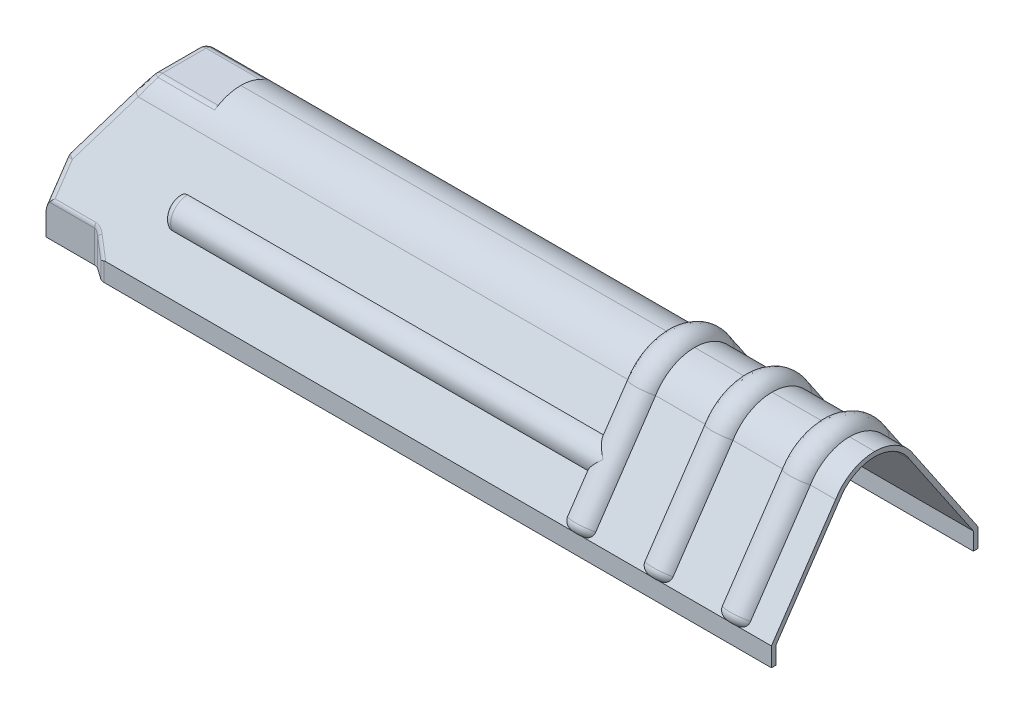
SolidWorks part; units mm, degrees
ref_plane "Front Plane" through (0, 0, 0) normal (0, 0, 1) x (1, 0, 0)
ref_plane "Top Plane" through (0, 0, 0) normal (0, 1, 0) x (1, 0, 0)
ref_plane "Right Plane" through (0, 0, 0) normal (1, 0, 0) x (0, 0, -1)
sketch "Sketch1" plane through (0, 0, 0) normal (0, 1, 0) x (1, 0, 0)
  line L0 (116.9121, 33.1724) -> (116.9121, -2.6924)
  line L3 (116.9121, 33.1724) -> (12.192, 33.1724)
  line L4 (12.192, -2.6924) -> (116.9121, -2.6924)
  line L5 (8.382, 0) -> (12.192, -2.6924)
  line L6 (12.192, 33.1724) -> (8.382, 30.48)
  line L7 (8.382, 30.48) -> (0, 30.48)
  line L8 (0, 30.48) -> (0, 0)
  line L10 (0, 0) -> (8.382, 0)
extrude "Boss-Extrude1" add sketch "Sketch1" along normal blind 50.8
sketch "Sketch2" plane through (0, 0, 0) normal (1, 0, 0) x (0, 0, -1)
  line L0 (15.24, 0) -> (15.24, 50.8) construction
  line L1 (-2.6924, 0) -> (33.1724, 0) construction
  line L2 (-2.6924, 50.8) -> (33.1724, 50.8) construction
  line L3 (-1.708, 0.6876) -> (-1.708, -0.0109)
  line L4 (-1.708, 3.1097) -> (-1.708, 0.6876)
  line L5 (1.6554, 8.0681) -> (-1.708, 3.1097)
  line L6 (8.8279, 18.6417) -> (1.6554, 8.0681)
  line L7 (32.188, -0.0109) -> (29.6545, -0.0109)
  line L8 (0.8255, -4.7972) -> (0.8255, -0.0109)
  line L9 (-8.1002, -4.7972) -> (0.8255, -4.7972)
  line L10 (-8.1002, 57.4184) -> (-8.1002, -4.7972)
  line L11 (38.5707, 57.4184) -> (-8.1002, 57.4184)
  line L12 (-1.708, -0.0109) -> (0.8255, -0.0109)
  line L17 (-8.0907, 57.4184) -> (38.5802, 57.4184)
  line L20 (38.5802, 57.4184) -> (38.5802, -4.7972)
  line L22 (38.5802, -4.7972) -> (29.6545, -4.7972)
  line L25 (29.6545, -4.7972) -> (29.6545, -0.0109)
  line L28 (21.6521, 18.6417) -> (28.8246, 8.0681)
  line L29 (28.8246, 8.0681) -> (32.188, 3.1097)
  line L30 (32.188, 3.1097) -> (32.188, 0.6876)
  line L34 (32.188, 0.6876) -> (32.188, -0.0109)
  arc A0 (21.6521, 18.6417) -> (8.8214, 18.6526) centre (15.2335, 14.7941) ccw
  arc A1 (8.8279, 18.6417) -> (21.6586, 18.6526) centre (15.2465, 14.7941) cw
  point P9 (-0.4445, 0)
  point P34 (30.9245, 0)
extrude "Cut-Extrude1" cut sketch "Sketch2" along normal through all
sketch "Sketch4" plane through (0, 0, 0) normal (0, 0, 1) x (1, 0, 0)
  line L0 (16.721, 22.9468) -> (-14.4484, 22.9468)
  line L1 (-14.4484, 22.9468) -> (-12.1824, 0)
  line L2 (16.721, 21.1478) -> (6.721, 21.1478)
  line L3 (6.721, 21.1478) -> (0, 9.77)
  line L4 (0, 18.6417) -> (0, 5.6276) construction
  line L5 (0, 9.77) -> (0, 0)
  line L6 (16.721, 21.1478) -> (16.721, 22.9468)
  line L7 (-12.1824, 0) -> (-0.17, 0)
  line L8 (0, 0) -> (-0.17, 0)
  dimension "D1" = 10
extrude "Cut-Extrude3" cut sketch "Sketch4" against normal through all
shell "Shell2" thickness 0.762
ref_plane "Plane1" through (116.9121, 0, 0) normal (1, 0, 0) x (0, 0, -1)
sketch "Sketch5" plane through (116.9121, 0, 0) normal (1, 0, 0) x (0, 0, -1)
  line L10 (21.0092, 18.2321) -> (31.426, 2.8757)
  line L11 (31.426, 2.8757) -> (31.426, 0)
  line L12 (31.426, 0) -> (32.188, 0)
  line L13 (32.188, 0) -> (32.188, 3.1097)
  line L14 (32.188, 3.1097) -> (21.6521, 18.6417)
  line L15 (8.8279, 18.6417) -> (-1.708, 3.1097)
  line L16 (-1.708, 3.1097) -> (-1.708, 0)
  line L17 (-1.708, 0) -> (-0.946, 0)
  line L18 (-0.946, 0) -> (-0.946, 2.8757)
  line L19 (-0.946, 2.8757) -> (9.4708, 18.2321)
  line L20 (21.0092, 18.2321) -> (31.426, 2.8757)
  line L21 (31.426, 2.8757) -> (31.426, 0)
  line L22 (31.426, 0) -> (32.188, 0)
  line L23 (32.188, 0) -> (32.188, 3.1097)
  line L24 (32.188, 3.1097) -> (21.6521, 18.6417)
  line L25 (8.8279, 18.6417) -> (-1.708, 3.1097)
  line L26 (-1.708, 3.1097) -> (-1.708, 0)
  line L27 (-1.708, 0) -> (-0.946, 0)
  line L28 (-0.946, 0) -> (-0.946, 2.8757)
  line L29 (-0.946, 2.8757) -> (9.4708, 18.2321)
  arc A4 (21.6521, 18.6417) -> (15.24, 22.2776) centre (15.2335, 14.7941) ccw
  arc A5 (15.24, 22.2776) -> (8.8279, 18.6417) centre (15.2465, 14.7941) ccw
  arc A6 (15.24, 21.5156) -> (9.4708, 18.2321) centre (15.2465, 14.7941) ccw
  arc A7 (21.0092, 18.2321) -> (15.24, 21.5156) centre (15.2335, 14.7941) ccw
  arc A8 (21.6521, 18.6417) -> (15.24, 22.2776) centre (15.2335, 14.7941) ccw
  arc A9 (15.24, 22.2776) -> (8.8279, 18.6417) centre (15.2465, 14.7941) ccw
  arc A10 (15.24, 21.5156) -> (9.4708, 18.2321) centre (15.2465, 14.7941) ccw
  arc A11 (21.0092, 18.2321) -> (15.24, 21.5156) centre (15.2335, 14.7941) ccw
  dimension "D1" = 0
extrude "Boss-Extrude2" add sketch "Sketch5" along normal blind 3.81
ref_plane "Plane2" through (0, 1.7734, 2.6144) normal (0, 0.5614, 0.8276) x (1, 0, 0)
sketch "Sketch6" plane through (0, 1.7734, 2.6144) normal (0, 0.5614, 0.8276) x (1, 0, 0)
  line L0 (120.7221, 10.9989) -> (-14.6738, 10.9989) construction
  line L1 (120.7221, 20.383) -> (120.7221, 1.6147) construction
  line L3 (17.145, 8.7129) -> (88.9, 8.7129)
  line L4 (17.145, 8.7129) -> (17.145, 13.2849)
  line L5 (17.145, 13.2849) -> (88.9, 13.2849)
  line L6 (88.9, 8.7129) -> (88.9, 13.2849)
  dimension "D1" = 4.572
  dimension "D2" = 2.286
  dimension "D3" = 71.755
  dimension "D4" = 17.145
extrude "Boss-Extrude3" add sketch "Sketch6" along normal blind 1.27
ref_plane "Plane3" through (0, 15.9335, -23.4892) normal (0, 0.5614, -0.8276) x (-1, 0, 0)
sketch "Sketch7" plane through (0, 15.9335, -23.4892) normal (0, 0.5614, -0.8276) x (-1, 0, 0)
  line L0 (-120.7221, -6.1116) -> (4.8342, -6.1116) construction
  line L1 (-120.7221, -15.4957) -> (-120.7221, 3.2725) construction
  line L3 (-17.145, -3.8256) -> (-88.9, -3.8256)
  line L4 (-17.145, -3.8256) -> (-17.145, -8.3976)
  line L5 (-17.145, -8.3976) -> (-88.9, -8.3976)
  line L6 (-88.9, -3.8256) -> (-88.9, -8.3976)
  dimension "D1" = 71.755
  dimension "D2" = 4.572
  dimension "D3" = 2.286
  dimension "D4" = 17.145
extrude "Boss-Extrude4" add sketch "Sketch7" along normal blind 1.27
sketch "Sketch9" plane through (0, 0, 0) normal (1, 0, 0) x (0, 0, -1)
  line L0 (3.7922, 13.4805) -> (4.8433, 12.7676) construction
  line L1 (2.2767, 8.9839) -> (4.8433, 12.7676) construction
  line L2 (2.2767, 8.9839) -> (-1.0737, 8.4693)
  line L3 (-1.0737, 8.4693) -> (6.9348, 23.8084)
  line L4 (6.9348, 23.8084) -> (29.0537, 23.8084)
  line L5 (29.0537, 23.8084) -> (32.6978, 8.0879)
  line L6 (32.6978, 8.0879) -> (28.2033, 8.9839)
  line L7 (25.6367, 12.7676) -> (26.2708, 15.9482)
  line L8 (26.2708, 15.9482) -> (18.7994, 22.5372)
  line L9 (18.7994, 22.5372) -> (8.4584, 21.8883)
  line L10 (8.4584, 21.8883) -> (4.8433, 12.7676)
  arc A0 (2.2767, 8.9839) -> (4.8433, 12.7676) centre (4.7371, 10.0773) cw
  arc A1 (25.6367, 12.7676) -> (28.2033, 8.9839) centre (25.7429, 10.0773) cw
extrude "Cut-Extrude4" cut sketch "Sketch9" along normal through all
ref_plane "Plane4" through (0, 16.8683, -11.4423) normal (0, 0.8276, -0.5614) x (1, 0, 0)
sketch "Sketch10" plane through (0, 16.8683, -11.4423) normal (0, 0.8276, -0.5614) x (1, 0, 0)
  line L0 (86.614, -3.1592) -> (91.186, -3.1592)
  line L1 (88.9, -4.4292) -> (88.9, -3.1592) construction
  line L2 (99.314, -3.1592) -> (103.886, -3.1592)
  line L4 (112.014, -3.1592) -> (116.586, -3.1592)
  arc A0 (86.614, -3.1592) -> (91.186, -3.1592) centre (88.9, -1.7368) ccw
  arc A1 (99.314, -3.1592) -> (103.886, -3.1592) centre (101.6, -1.7368) ccw
  arc A2 (112.014, -3.1592) -> (116.586, -3.1592) centre (114.3, -1.7368) ccw
  point P2 (88.9, -3.1592)
  point P6 (88.9, -4.4292)
  point P11 (101.6, -3.1592)
  point P13 (101.6, -4.4292)
  point P16 (114.3, -3.1592)
  point P18 (114.3, -4.4292)
  dimension "D1" = 4.572
  dimension "D2" = 31.8221
  dimension "D3" = 3
ref_plane "Plane5" through (0, 1.3363, -0.9064) normal (0, 0.8276, -0.5614) x (1, 0, 0)
sketch "Sketch11" plane through (0, 1.3363, -0.9064) normal (0, 0.8276, -0.5614) x (1, 0, 0)
  line L1 (116.586, -3.1592) -> (112.014, -3.1592)
  line L2 (86.614, -2.9301) -> (91.186, -2.9301)
  line L3 (103.886, -3.1592) -> (99.314, -3.1592)
  line L4 (112.014, -3.1592) -> (112.014, -2.9301)
  line L5 (91.186, -3.1592) -> (86.614, -3.1592)
  line L6 (103.886, -3.1592) -> (103.886, -2.9301)
  line L8 (86.614, -3.1592) -> (86.614, -2.9301)
  line L10 (116.586, -3.1592) -> (116.586, -2.9301)
  line L11 (99.314, -3.1592) -> (99.314, -2.9301)
  line L12 (91.186, -3.1592) -> (91.186, -2.9301)
  line L13 (99.314, -2.9301) -> (103.886, -2.9301)
  line L14 (112.014, -2.9301) -> (116.586, -2.9301)
  arc A1 (112.014, -3.1592) -> (116.586, -3.1592) centre (114.3, -1.7368) ccw
  arc A2 (112.014, -3.1592) -> (116.586, -3.1592) centre (114.3, -1.7368) ccw
  arc A3 (99.314, -3.1592) -> (103.886, -3.1592) centre (101.6, -1.7368) ccw
  arc A4 (99.314, -3.1592) -> (103.886, -3.1592) centre (101.6, -1.7368) ccw
  arc A5 (86.614, -3.1592) -> (91.186, -3.1592) centre (88.9, -1.7368) ccw
  arc A6 (86.614, -3.1592) -> (91.186, -3.1592) centre (88.9, -1.7368) ccw
  dimension "D1" = 0
  dimension "D2" = 0
  dimension "D3" = 0
ref_plane "Plane6" through (86.614, 0, 0) normal (1, 0, 0) x (0, 0, -1)
sketch "Sketch13" plane through (86.614, 0, 0) normal (1, 0, 0) x (0, 0, -1)
  line L0 (8.8279, 18.6417) -> (-1.708, 3.1097) construction
  line L1 (32.188, 3.1097) -> (21.6521, 18.6417) construction
  line L2 (8.8279, 18.6417) -> (-1.708, 3.1097)
  line L3 (32.188, 3.1097) -> (21.6521, 18.6417)
  arc A4 (8.8279, 18.6417) -> (21.6521, 18.6417) centre (15.24, 14.8056) cw
  point P2 (15.24, 22.2776)
sweep "Sweep4" add profiles "Sketch11" path "Sketch13"
fillet "Fillet2" radius 1.27 31 edges at (4.693, 5.3936, -0.762) (0.762, 2.6968, -0.762) (17.145, 10.8757, -3.56) (17.145, 10.8757, -26.92) (17.145, 11.5887, -2.509) (17.145, 11.5887, -27.971) (8.382, 2.8138, 0) (114.3, 3.8227, 2.759) (114.3, 3.8227, -33.239) (0, 2.8138, -30.48) (8.382, 2.8138, -30.48) (9.5905, 4.3687, 0.854) (4.191, 5.6276, 0) (101.6, 3.8227, 2.759) (101.6, 3.8227, -33.239) (10.7989, 1.5549, 1.708) (9.5905, 4.3687, -31.334) (4.191, 5.6276, -30.48) (10.7989, 1.5549, -32.188) (88.9, 3.8227, 2.759) (88.9, 3.8227, -33.239) (6.0675, 20.0415, -20.569) (11.721, 21.1478, -19.1875) (0, 7.6988, -29.075) (0, 7.6988, -1.405) (0, 9.77, -15.24) (11.721, 21.1478, -11.2925) (2.6203, 14.2059, -5.8189) (6.721, 21.1478, -15.24) (2.6203, 14.2059, -24.6611) (6.0675, 20.0415, -9.911)
